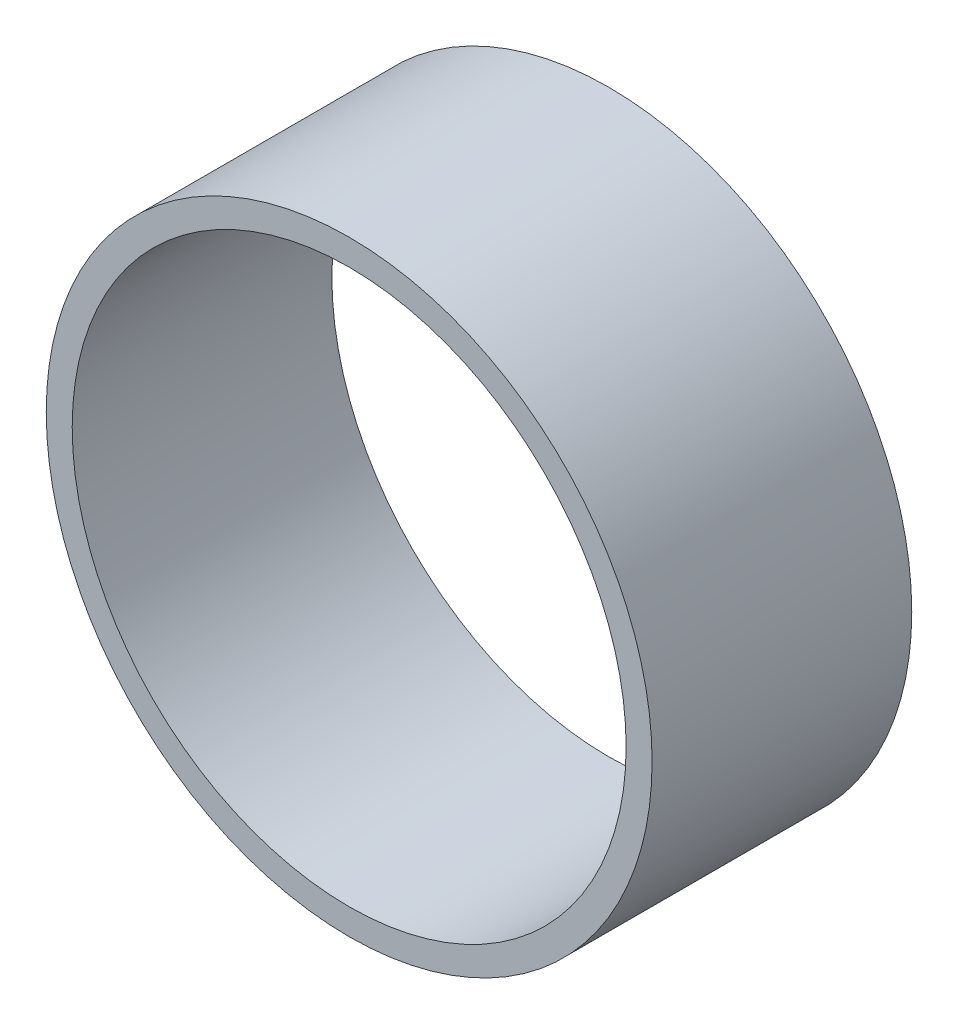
SolidWorks part; units mm, degrees
ref_plane "Front" through (0, 0, 0) normal (0, 0, 1) x (1, 0, 0)
ref_plane "Top" through (0, 0, 0) normal (0, 1, 0) x (1, 0, 0)
ref_plane "Right" through (0, 0, 0) normal (1, 0, 0) x (0, 0, -1)
sketch "Sketch1" plane through (0, 0, 0) normal (0, 0, 1) x (1, 0, 0)
  circle A0 centre (0, 0) radius 35
  circle A1 centre (0, 0) radius 32
  dimension "D1" = 70
  dimension "D2" = 3
extrude "Extrude1" add sketch "Sketch1" along normal blind 30
sketch "Sketch2" plane through (0, 0, 0) normal (0, 0, 1) x (1, 0, 0)
  line L0 (-30.5054, 27.3938) -> (-26.0412, 23.3849)
  line L1 (-30.5054, -27.3938) -> (-26.0412, -23.3849)
  arc A0 (-28.2733, 25.3894) -> (-28.2733, -25.3894) centre (0, 0) ccw construction
  arc A1 (-30.5054, 27.3938) -> (-30.5054, -27.3938) centre (0, 0) ccw
  arc A2 (-26.0412, 23.3849) -> (-26.0412, -23.3849) centre (0, 0) ccw
  circle A7 centre (0, 0) radius 35 construction
  dimension "D3" = 60
  dimension "D1" = 3
  dimension "D2" = 3
